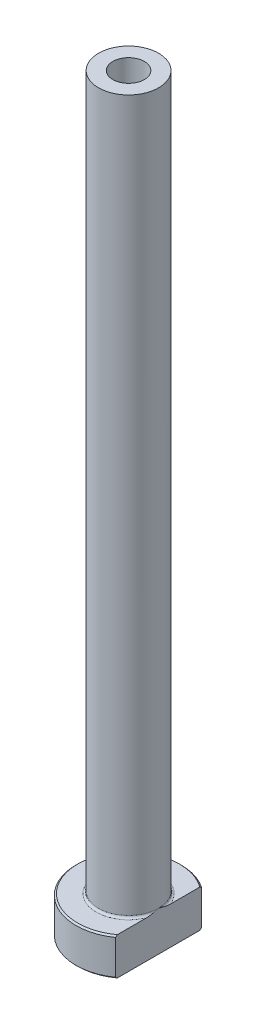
SolidWorks part; units mm, degrees
ref_plane "Front Plane" through (0, 0, 0) normal (0, 0, 1) x (1, 0, 0)
ref_plane "Top Plane" through (0, 0, 0) normal (0, 1, 0) x (1, 0, 0)
ref_plane "Right Plane" through (0, 0, 0) normal (1, 0, 0) x (0, 0, -1)
sketch "Sketch1" plane through (0, 0, 0) normal (0, 0, 1) x (1, 0, 0)
  line L0 (-2.1, 100) -> (-4, 100)
  line L1 (-4, 100) -> (-4, 5)
  line L2 (-4, 5) -> (-7, 5)
  line L3 (-7, 5) -> (-7, 0)
  line L4 (4.125, 0) -> (-4.125, 0) construction
  line L5 (-7, 0) -> (-2.35, 0)
  line L6 (-2.1, 55) -> (-2.1, 100)
  line L7 (0, 92.1877) -> (0, -15.5353) construction
  line L8 (0, -5.5) -> (0, 5.5) construction
  line L9 (-2.1, 55) -> (-2.35, 43)
  line L10 (-2.35, 43) -> (-2.35, 0)
  dimension "D1" = 0.25
  dimension "ID" = 4.2
  dimension "OD" = 8
  dimension "L" = 100
  dimension "H" = 14
  dimension "T" = 5
  dimension "N" = 45
  dimension "D2" = 12
  dimension "L-N" = 55
revolve "Revolve1" add sketch "Sketch1" angle 360 about L7
fillet "Fillet1" radius 0.3 1 edges at (0, 5, 4)
chamfer "Chamfer1" distance 0.2 angle 45 2 edges at (0, 5, 7) (0, 0, 7)
sketch "Sketch2" plane through (0, 0, 0) normal (0, -1, 0) x (1, 0, 0)
  line L0 (4, 5.7446) -> (4, -5.7446)
  circle A0 centre (0, 0) radius 7 construction
  arc A1 (4, 5.7446) -> (4, -5.7446) centre (0, 0) cw
  circle A2 centre (0, 0) radius 4 construction
extrude "Cut-Extrude1" cut sketch "Sketch2" against normal through all
chamfer "Chamfer2" distance 0.5 angle 45 1 edges at (0, 0, 2.35)
